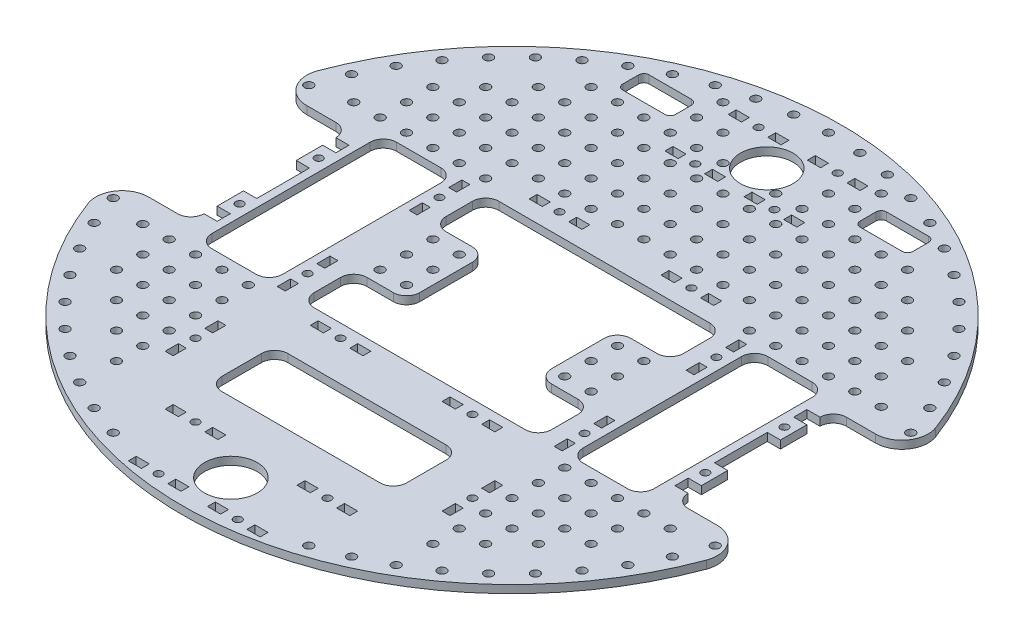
SolidWorks part; units mm, degrees
other "<Surchassis 5mm>-<<Chassis_Cachan_Coupe_2019>-<Bloc_moteur_assemble-1/Chassis_Cachan-1-solid1>>"
other "<Surchassis 5mm>-<<Chassis_Cachan_Coupe_2019>-<Assemblage_roue-1/Roue-1-solid1>>"
other "<Surchassis 5mm>-<<Chassis_Cachan_Coupe_2019>-<Assemblage_roue-1/spur gear_iso-1-solid1>>"
other "<Surchassis 5mm>-<<Chassis_Cachan_Coupe_2019>-<Assemblage_roue-2/Roue-1-solid1>>"
other "<Surchassis 5mm>-<<Chassis_Cachan_Coupe_2019>-<Assemblage_roue-2/spur gear_iso-1-solid1>>"
other "<Surchassis 5mm>-<Fillet1>"
ref_plane "Plan de face" through (0, 0, 0) normal (0, 0, 1) x (1, 0, 0)
ref_plane "Plan de dessus" through (0, 0, 0) normal (0, 1, 0) x (1, 0, 0)
ref_plane "Plan de droite" through (0, 0, 0) normal (1, 0, 0) x (0, 0, -1)
sketch "Esquisse1-Surchassis 5mm" plane through (19.3534, 43.7556, -15.1193) normal (0, 1, 0) x (1, 0, 0)
  line L0 (-90, 0) -> (90, 0) construction
  line L1 (-96, -30) -> (-113.0885, -30)
  line L2 (-51, 41.5) -> (58.6644, 41.5) construction
  line L4 (-96, -25) -> (-96, -30)
  line L5 (88.3, 10) -> (88.3, 20) construction
  line L6 (86.8, -10) -> (91.8, -10)
  line L7 (86.8, 10) -> (86.8, 5)
  line L8 (-89.8, -25) -> (-96, -25)
  line L9 (91.8, -10) -> (91.8, -20)
  line L10 (86.8, 5) -> (89.8, 5) construction
  line L11 (86.8, 20) -> (86.8, 25)
  line L12 (-86.8, -25) -> (-89.8, -25)
  line L13 (91.8, -20) -> (86.8, -20)
  line L14 (-86.8, -20) -> (-86.8, -25)
  line L15 (88.3, 15) -> (81.3276, 15) construction
  line L16 (88.3, -20) -> (88.3, -10) construction
  line L17 (86.8, -20) -> (86.8, -25)
  line L18 (-91.8, -20) -> (-86.8, -20)
  line L19 (-91.8, -10) -> (-91.8, -20)
  line L20 (86.8, -25) -> (89.8, -25)
  line L21 (86.8, -10) -> (86.8, -5)
  line L22 (-86.8, -10) -> (-91.8, -10)
  line L23 (89.8, -25) -> (96, -25)
  line L24 (86.8, -5) -> (89.8, -5) construction
  line L25 (88.3, -15) -> (81.3276, -15) construction
  line L26 (96, -25) -> (96, -30)
  line L27 (86.8, 10) -> (91.8, 10)
  line L28 (91.8, 10) -> (91.8, 20)
  line L29 (91.8, 20) -> (86.8, 20)
  line L30 (96, 30) -> (113.0885, 30)
  line L31 (96, 30) -> (96, -30) construction
  line L32 (96, -30) -> (113.0885, -30)
  line L33 (113.0885, 30) -> (113.0885, -30) construction
  line L34 (-86.8, -10) -> (-86.8, -5)
  line L35 (-86.8, -5) -> (-86.8, 5)
  line L36 (-86.8, 10) -> (-86.8, 5)
  line L37 (-86.8, 10) -> (-91.8, 10)
  line L38 (86.8, 25) -> (96, 25)
  line L39 (86.8, -5) -> (86.8, 5)
  line L40 (96, 25) -> (96, 30)
  line L41 (-91.8, 10) -> (-91.8, 20)
  line L42 (-91.8, 20) -> (-86.8, 20)
  line L43 (-86.8, 20) -> (-86.8, 25)
  line L44 (-86.8, 25) -> (-96, 25)
  line L45 (-96, 25) -> (-96, 30)
  line L46 (-96, 30) -> (-113.0885, 30)
  line L59 (0, 0) -> (0, -125) construction
  line L82 (0, -93.5) -> (0, -41.5) construction
  line L83 (-51, -93.5) -> (51, -93.5) construction
  line L84 (-51, -93.5) -> (-51, -41.5) construction
  line L85 (-51, -41.5) -> (51, -41.5) construction
  line L86 (51, -93.5) -> (51, -41.5) construction
  line L87 (-51, -67.5) -> (51, -67.5) construction
  line L91 (-44.985, -93.5) -> (-35.015, -93.5) construction
  line L94 (-24.985, -93.5) -> (-15.015, -93.5) construction
  line L98 (-4.985, -93.5) -> (4.985, -93.5) construction
  line L102 (15.015, -93.5) -> (24.985, -93.5) construction
  line L106 (35.015, -93.5) -> (44.985, -93.5) construction
  line L108 (-51, -41.5) -> (51, -41.5) construction
  line L110 (35.015, -41.5) -> (44.985, -41.5) construction
  line L114 (15.015, -41.5) -> (24.985, -41.5) construction
  line L118 (-4.985, -41.5) -> (4.985, -41.5) construction
  line L122 (-24.985, -41.5) -> (-15.015, -41.5) construction
  line L125 (-44.985, -41.5) -> (-35.015, -41.5) construction
  line L129 (51, -93.5) -> (51, -41.5) construction
  line L131 (-51, -93.485) -> (-51, -83.515) construction
  line L135 (-51, -73.485) -> (-51, -63.515) construction
  line L139 (-51, -53.485) -> (-51, -43.515) construction
  line L144 (51, -53.485) -> (51, -43.515) construction
  line L148 (51, -73.485) -> (51, -63.515) construction
  line L152 (51, -93.485) -> (51, -83.515) construction
  line L154 (-51, -93.485) -> (-51, -93.5) construction
  line L155 (-51, -93.5) -> (-44.985, -93.5) construction
  line L156 (-35.015, -93.5) -> (-24.985, -93.5) construction
  line L157 (-15.015, -93.5) -> (-4.985, -93.5) construction
  line L158 (4.985, -93.5) -> (15.015, -93.5) construction
  line L159 (24.985, -93.5) -> (35.015, -93.5) construction
  line L160 (44.985, -93.5) -> (51, -93.5) construction
  line L161 (51, -93.5) -> (51, -93.485) construction
  line L162 (51, -83.515) -> (51, -73.485) construction
  line L163 (51, -63.515) -> (51, -53.485) construction
  line L164 (51, -43.515) -> (51, -41.5) construction
  line L165 (51, -41.5) -> (44.985, -41.5) construction
  line L166 (35.015, -41.5) -> (24.985, -41.5) construction
  line L167 (15.015, -41.5) -> (4.985, -41.5) construction
  line L168 (-4.985, -41.5) -> (-15.015, -41.5) construction
  line L169 (-24.985, -41.5) -> (-35.015, -41.5) construction
  line L170 (-44.985, -41.5) -> (-51, -41.5) construction
  line L171 (-51, -41.5) -> (-51, -43.515) construction
  line L172 (-51, -53.485) -> (-51, -63.515) construction
  line L173 (-51, -73.485) -> (-51, -83.515) construction
  line L174 (125.9773, 20) -> (118.7192, 20) construction
  line L181 (-27.8375, -117.5) -> (13.4826, -117.5) construction
  line L190 (-20, -96.2) -> (-20, -145.4677) construction
  line L191 (-40, -96.2) -> (-40, -138) construction
  line L253 (-50.9895, 107) -> (24.0329, 107) construction
  line L262 (-38.4384, 83) -> (36.5098, 83) construction
  circle A0 centre (0, 0) radius 125
  circle A1 centre (88.3, 15) radius 1.5
  circle A2 centre (88.3, -15) radius 1.5
  circle A3 centre (-88.3, -15) radius 1.5
  circle A4 centre (-88.3, 15) radius 1.5
  arc A5 (-113.0885, -30) -> (-113.0885, 30) centre (0, 0) cw
  arc A32 (113.0885, -30) -> (113.0885, 30) centre (0, 0) ccw
  point P8 (0, 0)
  point P14 (36.5098, 83)
  point P17 (-38.4384, 83)
  point P18 (39.0316, 107)
  point P27 (-35.9908, 107)
  point P34 (0, 0)
  point P35 (0, 0)
  point P115 (86.8, 0)
  line B0 (-52.5, 20) -> (-52.5, 30) construction
  line B1 (-54, 20) -> (-54, 15)
  line B2 (-54, 20) -> (-51, 20)
  line B3 (-51, 20) -> (-51, 15)
  line B4 (-54, 15) -> (-51, 15)
  line B5 (-54, 30) -> (-54, 35)
  line B6 (-54, 30) -> (-51, 30)
  line B7 (-51, 30) -> (-51, 35)
  line B8 (-54, 35) -> (-51, 35)
  line B9 (-52.5, 25) -> (-59.4724, 25) construction
  circle B10 centre (-52.5, 25) radius 1.5
  line B11 (-52.5, -30) -> (-52.5, -20) construction
  line B12 (-54, -30) -> (-54, -35)
  line B13 (-54, -30) -> (-51, -30)
  line B14 (-51, -30) -> (-51, -35)
  line B15 (-54, -35) -> (-51, -35)
  line B16 (-54, -20) -> (-54, -15)
  line B17 (-54, -20) -> (-51, -20)
  line B18 (-51, -20) -> (-51, -15)
  line B19 (-54, -15) -> (-51, -15)
  line B20 (-52.5, -25) -> (-59.4724, -25) construction
  circle B21 centre (-52.5, -25) radius 1.5
  line B22 (52.5, 30) -> (52.5, 20) construction
  line B23 (54, 30) -> (54, 35)
  line B24 (54, 30) -> (51, 30)
  line B25 (51, 30) -> (51, 35)
  line B26 (54, 35) -> (51, 35)
  line B27 (54, 20) -> (54, 15)
  line B28 (54, 20) -> (51, 20)
  line B29 (51, 20) -> (51, 15)
  line B30 (54, 15) -> (51, 15)
  line B31 (52.5, 25) -> (59.4724, 25) construction
  circle B32 centre (52.5, 25) radius 1.5
  line B33 (52.5, -20) -> (52.5, -30) construction
  line B34 (54, -20) -> (54, -15)
  line B35 (54, -20) -> (51, -20)
  line B36 (51, -20) -> (51, -15)
  line B37 (54, -15) -> (51, -15)
  line B38 (54, -30) -> (54, -35)
  line B39 (54, -30) -> (51, -30)
  line B40 (51, -30) -> (51, -35)
  line B41 (54, -35) -> (51, -35)
  line B42 (52.5, -25) -> (59.4724, -25) construction
  circle B43 centre (52.5, -25) radius 1.5
  line B44 (-30, 43) -> (-20, 43) construction
  line B45 (-30, 44.5) -> (-35, 44.5)
  line B46 (-30, 44.5) -> (-30, 41.5)
  line B47 (-30, 41.5) -> (-35, 41.5)
  line B48 (-35, 44.5) -> (-35, 41.5)
  line B49 (-20, 44.5) -> (-15, 44.5)
  line B50 (-20, 44.5) -> (-20, 41.5)
  line B51 (-20, 41.5) -> (-15, 41.5)
  line B52 (-15, 44.5) -> (-15, 41.5)
  line B53 (-25, 43) -> (-25, 49.9724) construction
  circle B54 centre (-25, 43) radius 1.5
  line B55 (20, 43) -> (30, 43) construction
  line B56 (20, 44.5) -> (15, 44.5)
  line B57 (20, 44.5) -> (20, 41.5)
  line B58 (20, 41.5) -> (15, 41.5)
  line B59 (15, 44.5) -> (15, 41.5)
  line B60 (30, 44.5) -> (35, 44.5)
  line B61 (30, 44.5) -> (30, 41.5)
  line B62 (30, 41.5) -> (35, 41.5)
  line B63 (35, 44.5) -> (35, 41.5)
  line B64 (25, 43) -> (25, 49.9724) construction
  circle B65 centre (25, 43) radius 1.5
  line B66 (-52.5, -72.5) -> (-52.5, -62.5) construction
  line B67 (-54, -72.5) -> (-54, -77.5)
  line B68 (-54, -72.5) -> (-51, -72.5)
  line B69 (-51, -72.5) -> (-51, -77.5)
  line B70 (-54, -77.5) -> (-51, -77.5)
  line B71 (-54, -62.5) -> (-54, -57.5)
  line B72 (-54, -62.5) -> (-51, -62.5)
  line B73 (-51, -62.5) -> (-51, -57.5)
  line B74 (-54, -57.5) -> (-51, -57.5)
  line B75 (-52.5, -67.5) -> (-59.4724, -67.5) construction
  circle B76 centre (-52.5, -67.5) radius 1.5
  line B77 (20, -40) -> (30, -40) construction
  line B78 (20, -38.5) -> (15, -38.5)
  line B79 (20, -38.5) -> (20, -41.5)
  line B80 (20, -41.5) -> (15, -41.5)
  line B81 (15, -38.5) -> (15, -41.5)
  line B82 (30, -38.5) -> (35, -38.5)
  line B83 (30, -38.5) -> (30, -41.5)
  line B84 (30, -41.5) -> (35, -41.5)
  line B85 (35, -38.5) -> (35, -41.5)
  line B86 (25, -40) -> (25, -33.0276) construction
  circle B87 centre (25, -40) radius 1.5
  line B88 (-30, -40) -> (-20, -40) construction
  line B89 (-30, -38.5) -> (-35, -38.5)
  line B90 (-30, -38.5) -> (-30, -41.5)
  line B91 (-30, -41.5) -> (-35, -41.5)
  line B92 (-35, -38.5) -> (-35, -41.5)
  line B93 (-20, -38.5) -> (-15, -38.5)
  line B94 (-20, -38.5) -> (-20, -41.5)
  line B95 (-20, -41.5) -> (-15, -41.5)
  line B96 (-15, -38.5) -> (-15, -41.5)
  line B97 (-25, -40) -> (-25, -33.0276) construction
  circle B98 centre (-25, -40) radius 1.5
  line B99 (-30, -95) -> (-20, -95) construction
  line B100 (-30, -93.5) -> (-35, -93.5)
  line B101 (-30, -93.5) -> (-30, -96.5)
  line B102 (-30, -96.5) -> (-35, -96.5)
  line B103 (-35, -93.5) -> (-35, -96.5)
  line B104 (-20, -93.5) -> (-15, -93.5)
  line B105 (-20, -93.5) -> (-20, -96.5)
  line B106 (-20, -96.5) -> (-15, -96.5)
  line B107 (-15, -93.5) -> (-15, -96.5)
  line B108 (-25, -95) -> (-25, -88.0276) construction
  circle B109 centre (-25, -95) radius 1.5
  line B110 (20, -95) -> (30, -95) construction
  line B111 (20, -93.5) -> (15, -93.5)
  line B112 (20, -93.5) -> (20, -96.5)
  line B113 (20, -96.5) -> (15, -96.5)
  line B114 (15, -93.5) -> (15, -96.5)
  line B115 (30, -93.5) -> (35, -93.5)
  line B116 (30, -93.5) -> (30, -96.5)
  line B117 (30, -96.5) -> (35, -96.5)
  line B118 (35, -93.5) -> (35, -96.5)
  line B119 (25, -95) -> (25, -88.0276) construction
  circle B120 centre (25, -95) radius 1.5
  line B121 (52.5, -62.5) -> (52.5, -72.5) construction
  line B122 (54, -62.5) -> (54, -57.5)
  line B123 (54, -62.5) -> (51, -62.5)
  line B124 (51, -62.5) -> (51, -57.5)
  line B125 (54, -57.5) -> (51, -57.5)
  line B126 (54, -72.5) -> (54, -77.5)
  line B127 (54, -72.5) -> (51, -72.5)
  line B128 (51, -72.5) -> (51, -77.5)
  line B129 (54, -77.5) -> (51, -77.5)
  line B130 (52.5, -67.5) -> (59.4724, -67.5) construction
  circle B131 centre (52.5, -67.5) radius 1.5
  line B132 (10, -119) -> (20, -119) construction
  line B133 (10, -117.5) -> (5, -117.5)
  line B134 (10, -117.5) -> (10, -120.5)
  line B135 (10, -120.5) -> (5, -120.5)
  line B136 (5, -117.5) -> (5, -120.5)
  line B137 (20, -117.5) -> (25, -117.5)
  line B138 (20, -117.5) -> (20, -120.5)
  line B139 (20, -120.5) -> (25, -120.5)
  line B140 (25, -117.5) -> (25, -120.5)
  line B141 (15, -119) -> (15, -112.0276) construction
  circle B142 centre (15, -119) radius 1.5
  line B143 (-20, -119) -> (-10, -119) construction
  line B144 (-20, -117.5) -> (-25, -117.5)
  line B145 (-20, -117.5) -> (-20, -120.5)
  line B146 (-20, -120.5) -> (-25, -120.5)
  line B147 (-25, -117.5) -> (-25, -120.5)
  line B148 (-10, -117.5) -> (-5, -117.5)
  line B149 (-10, -117.5) -> (-10, -120.5)
  line B150 (-10, -120.5) -> (-5, -120.5)
  line B151 (-5, -117.5) -> (-5, -120.5)
  line B152 (-15, -119) -> (-15, -112.0276) construction
  circle B153 centre (-15, -119) radius 1.5
  line B154 (-20, 84.5) -> (-10, 84.5) construction
  line B155 (-20, 86) -> (-25, 86)
  line B156 (-20, 86) -> (-20, 83)
  line B157 (-20, 83) -> (-25, 83)
  line B158 (-25, 86) -> (-25, 83)
  line B159 (-10, 86) -> (-5, 86)
  line B160 (-10, 86) -> (-10, 83)
  line B161 (-10, 83) -> (-5, 83)
  line B162 (-5, 86) -> (-5, 83)
  line B163 (-15, 84.5) -> (-15, 91.4724) construction
  circle B164 centre (-15, 84.5) radius 1.5
  line B165 (10, 84.5) -> (20, 84.5) construction
  line B166 (10, 86) -> (5, 86)
  line B167 (10, 86) -> (10, 83)
  line B168 (10, 83) -> (5, 83)
  line B169 (5, 86) -> (5, 83)
  line B170 (20, 86) -> (25, 86)
  line B171 (20, 86) -> (20, 83)
  line B172 (20, 83) -> (25, 83)
  line B173 (25, 86) -> (25, 83)
  line B174 (15, 84.5) -> (15, 91.4724) construction
  circle B175 centre (15, 84.5) radius 1.5
  line B176 (10, 108.5) -> (20, 108.5) construction
  line B177 (10, 110) -> (5, 110)
  line B178 (10, 110) -> (10, 107)
  line B179 (10, 107) -> (5, 107)
  line B180 (5, 110) -> (5, 107)
  line B181 (20, 110) -> (25, 110)
  line B182 (20, 110) -> (20, 107)
  line B183 (20, 107) -> (25, 107)
  line B184 (25, 110) -> (25, 107)
  line B185 (15, 108.5) -> (15, 115.4724) construction
  circle B186 centre (15, 108.5) radius 1.5
  line B187 (-20, 108.5) -> (-10, 108.5) construction
  line B188 (-20, 110) -> (-25, 110)
  line B189 (-20, 110) -> (-20, 107)
  line B190 (-20, 107) -> (-25, 107)
  line B191 (-25, 110) -> (-25, 107)
  line B192 (-10, 110) -> (-5, 110)
  line B193 (-10, 110) -> (-10, 107)
  line B194 (-10, 107) -> (-5, 107)
  line B195 (-5, 110) -> (-5, 107)
  line B196 (-15, 108.5) -> (-15, 115.4724) construction
  circle B197 centre (-15, 108.5) radius 1.5
sketch_block_instance "Insert M3 avec plot 3mm coté trou-21-18-1"
sketch_block "Insert M3 avec plot 3mm coté trou-21-18" parameters "D2"=3, "D1"=3, "D3"=5, "D4"=10
sketch_block_instance "Insert M3 avec plot 3mm coté trou-21-18-2"
sketch_block_instance "Insert M3 avec plot 3mm coté trou-21-18-3"
sketch_block_instance "Insert M3 avec plot 3mm coté trou-21-18-4"
sketch_block_instance "Insert M3 avec plot 3mm coté trou-21-18-5"
sketch_block_instance "Insert M3 avec plot 3mm coté trou-21-18-6"
sketch_block_instance "Insert M3 avec plot 3mm coté trou-21-18-7"
sketch_block_instance "Insert M3 avec plot 3mm coté trou-21-18-8"
sketch_block_instance "Insert M3 avec plot 3mm coté trou-21-18-9"
sketch_block_instance "Insert M3 avec plot 3mm coté trou-21-18-10"
sketch_block_instance "Insert M3 avec plot 3mm coté trou-21-18-11"
sketch_block_instance "Insert M3 avec plot 3mm coté trou-21-18-12"
sketch_block_instance "Insert M3 avec plot 3mm coté trou-21-18-13"
sketch_block_instance "Insert M3 avec plot 3mm coté trou-21-18-14"
sketch_block_instance "Insert M3 avec plot 3mm coté trou-21-18-15"
sketch_block_instance "Insert M3 avec plot 3mm coté trou-21-18-16"
sketch_block_instance "Insert M3 avec plot 3mm coté trou-21-18-17"
sketch_block_instance "Insert M3 avec plot 3mm coté trou-21-17-17" parameters "D4"=3.4, "D8"=297, "D21"=312.2688, "D5"=117, "D23"=3, "D28"=3, "D1"=247, "D2"=18.4229, "D3"=23.1749, "D6"=60, "D7"=60, "D9"=4.3401, "D10"=9.5969, "D11"=10, "D13"=10, "D12"=6.3355, "D14"=131.6053, "D15"=51.4209, "D16"=100, "D17"=14.4362, "D18"=4.6468, "D19"=14.5354, "D20"=3, "D22"=3.3217, "D24"=10, "D25"=10.15, "D26"=10.15, "D27"=2.85, "D29"=13.5312, "D30"=16.4043, "D31"=7.4814, "D32"=12.925, "D33"=12.925, "D34"=3, "D35"=100, "D36"=90, "D37"=29.1125, "D38"=30.7336, "D39"=21.1863, "D40"=25.1811, "D41"=18.0976
sketch "Esquisse2-Surchassis 5mm" plane through (19.3534, 46.7556, -15.1193) normal (0, 1, 0) x (1, 0, 0)
  line L0 (-125, 0) -> (125, 0) construction
  line L1 (0, -125) -> (0, 125) construction
  line L2 (-45, -35) -> (-45, -15)
  line L3 (-45, 35) -> (-15, 35)
  line L6 (-50, -42.5) -> (50, -42.5)
  line L7 (-50, -42.5) -> (-50, -92.5)
  line L8 (-50, -92.5) -> (50, -92.5)
  line L10 (50, -42.5) -> (50, -92.5)
  line L14 (-45, 35) -> (-45, 15)
  line L15 (-45, 15) -> (-15, 15)
  line L16 (-15, 35) -> (-15, 15)
  line L17 (-45, -15) -> (-15, -15)
  line L18 (-15, -35) -> (-15, -15)
  line L19 (-45, -35) -> (-15, -35)
  line L20 (45, -35) -> (45, -15)
  line L21 (45, -35) -> (15, -35)
  line L22 (15, -35) -> (15, -15)
  line L23 (45, -15) -> (15, -15)
  line L24 (45, 35) -> (45, 15)
  line L25 (45, 15) -> (15, 15)
  line L26 (15, 35) -> (15, 15)
  line L27 (45, 35) -> (15, 35)
  line L28 (55, 105) -> (55, 95)
  line L29 (-55, 105) -> (-35, 105)
  line L30 (-55, 105) -> (-55, 95)
  line L31 (-55, 95) -> (-35, 95)
  line L32 (-35, 105) -> (-35, 95)
  line L33 (55, 95) -> (35, 95)
  line L34 (35, 105) -> (35, 95)
  line L35 (55, 105) -> (35, 105)
  circle A0 centre (0, 0) radius 1.65
  circle A2 centre (10, 0) radius 1.65
  circle A3 centre (20, 0) radius 1.65
  circle A4 centre (30, 0) radius 1.65
  circle A5 centre (40, 0) radius 1.65
  circle A6 centre (50, 0) radius 1.65 construction
  circle A7 centre (60, 0) radius 1.65
  circle A8 centre (70, 0) radius 1.65
  circle A9 centre (80, 0) radius 1.65
  circle A10 centre (90, 0) radius 1.65 construction
  circle A11 centre (100, 0) radius 1.65 construction
  circle A12 centre (110, 0) radius 1.65 construction
  circle A13 centre (120, 0) radius 1.65 construction
  circle A14 centre (10, 10) radius 1.65
  circle A15 centre (20, 10) radius 1.65
  circle A16 centre (30, 10) radius 1.65
  circle A17 centre (40, 10) radius 1.65
  circle A18 centre (50, 10) radius 1.65 construction
  circle A19 centre (60, 10) radius 1.65
  circle A20 centre (70, 10) radius 1.65
  circle A21 centre (80, 10) radius 1.65
  circle A22 centre (90, 10) radius 1.65 construction
  circle A23 centre (100, 10) radius 1.65 construction
  circle A24 centre (110, 10) radius 1.65 construction
  circle A25 centre (120, 10) radius 1.65 construction
  circle A26 centre (10, 20) radius 1.65
  circle A27 centre (20, 20) radius 1.65 construction
  circle A28 centre (30, 20) radius 1.65 construction
  circle A29 centre (40, 20) radius 1.65 construction
  circle A30 centre (50, 20) radius 1.65 construction
  circle A31 centre (60, 20) radius 1.65
  circle A32 centre (70, 20) radius 1.65
  circle A33 centre (80, 20) radius 1.65
  circle A34 centre (90, 20) radius 1.65 construction
  circle A35 centre (100, 20) radius 1.65 construction
  circle A36 centre (110, 20) radius 1.65 construction
  circle A37 centre (120, 20) radius 1.65 construction
  circle A38 centre (10, 30) radius 1.65
  circle A39 centre (20, 30) radius 1.65 construction
  circle A40 centre (30, 30) radius 1.65 construction
  circle A41 centre (40, 30) radius 1.65 construction
  circle A42 centre (50, 30) radius 1.65 construction
  circle A43 centre (60, 30) radius 1.65
  circle A44 centre (70, 30) radius 1.65
  circle A45 centre (80, 30) radius 1.65
  circle A46 centre (90, 30) radius 1.65 construction
  circle A47 centre (100, 30) radius 1.65 construction
  circle A48 centre (110, 30) radius 1.65 construction
  circle A49 centre (120, 30) radius 1.65 construction
  circle A50 centre (10, 40) radius 1.65 construction
  circle A51 centre (20, 40) radius 1.65 construction
  circle A52 centre (30, 40) radius 1.65 construction
  circle A53 centre (40, 40) radius 1.65 construction
  circle A54 centre (50, 40) radius 1.65
  circle A55 centre (60, 40) radius 1.65
  circle A56 centre (70, 40) radius 1.65
  circle A57 centre (80, 40) radius 1.65
  circle A58 centre (90, 40) radius 1.65
  circle A59 centre (100, 40) radius 1.65
  circle A60 centre (110, 40) radius 1.65 construction
  circle A61 centre (120, 40) radius 1.65 construction
  circle A62 centre (10, 50) radius 1.65
  circle A63 centre (20, 50) radius 1.65
  circle A64 centre (30, 50) radius 1.65
  circle A65 centre (40, 50) radius 1.65
  circle A66 centre (50, 50) radius 1.65
  circle A67 centre (60, 50) radius 1.65
  circle A68 centre (70, 50) radius 1.65
  circle A69 centre (80, 50) radius 1.65
  circle A70 centre (90, 50) radius 1.65
  circle A71 centre (100, 50) radius 1.65 construction
  circle A72 centre (110, 50) radius 1.65 construction
  circle A73 centre (120, 50) radius 1.65 construction
  circle A74 centre (10, 60) radius 1.65
  circle A75 centre (20, 60) radius 1.65
  circle A76 centre (30, 60) radius 1.65
  circle A77 centre (40, 60) radius 1.65
  circle A78 centre (50, 60) radius 1.65
  circle A79 centre (60, 60) radius 1.65
  circle A80 centre (70, 60) radius 1.65
  circle A81 centre (80, 60) radius 1.65
  circle A82 centre (90, 60) radius 1.65
  circle A83 centre (100, 60) radius 1.65 construction
  circle A84 centre (110, 60) radius 1.65 construction
  circle A85 centre (120, 60) radius 1.65 construction
  circle A86 centre (10, 70) radius 1.65
  circle A87 centre (20, 70) radius 1.65
  circle A88 centre (30, 70) radius 1.65
  circle A89 centre (40, 70) radius 1.65
  circle A90 centre (50, 70) radius 1.65
  circle A91 centre (60, 70) radius 1.65
  circle A92 centre (70, 70) radius 1.65
  circle A93 centre (80, 70) radius 1.65
  circle A94 centre (90, 70) radius 1.65 construction
  circle A95 centre (100, 70) radius 1.65 construction
  circle A96 centre (110, 70) radius 1.65 construction
  circle A97 centre (120, 70) radius 1.65 construction
  circle A98 centre (10, 80) radius 1.65
  circle A99 centre (20, 80) radius 1.65
  circle A100 centre (30, 80) radius 1.65
  circle A101 centre (40, 80) radius 1.65
  circle A102 centre (50, 80) radius 1.65
  circle A103 centre (60, 80) radius 1.65
  circle A104 centre (70, 80) radius 1.65
  circle A105 centre (80, 80) radius 1.65 construction
  circle A106 centre (90, 80) radius 1.65 construction
  circle A107 centre (100, 80) radius 1.65 construction
  circle A108 centre (110, 80) radius 1.65 construction
  circle A109 centre (120, 80) radius 1.65 construction
  circle A110 centre (10, 90) radius 1.65
  circle A111 centre (20, 90) radius 1.65
  circle A112 centre (30, 90) radius 1.65
  circle A113 centre (40, 90) radius 1.65
  circle A114 centre (50, 90) radius 1.65
  circle A115 centre (60, 90) radius 1.65
  circle A116 centre (70, 90) radius 1.65 construction
  circle A117 centre (80, 90) radius 1.65 construction
  circle A118 centre (90, 90) radius 1.65 construction
  circle A119 centre (100, 90) radius 1.65 construction
  circle A120 centre (110, 90) radius 1.65 construction
  circle A121 centre (120, 90) radius 1.65 construction
  circle A122 centre (10, 100) radius 1.65 construction
  circle A123 centre (20, 100) radius 1.65
  circle A124 centre (30, 100) radius 1.65
  circle A125 centre (40, 100) radius 1.65 construction
  circle A126 centre (50, 100) radius 1.65 construction
  circle A127 centre (60, 100) radius 1.65 construction
  circle A128 centre (70, 100) radius 1.65 construction
  circle A129 centre (80, 100) radius 1.65 construction
  circle A130 centre (90, 100) radius 1.65 construction
  circle A131 centre (100, 100) radius 1.65 construction
  circle A132 centre (110, 100) radius 1.65 construction
  circle A133 centre (120, 100) radius 1.65 construction
  circle A134 centre (10, 110) radius 1.65 construction
  circle A135 centre (20, 110) radius 1.65 construction
  circle A136 centre (30, 110) radius 1.65
  circle A137 centre (40, 110) radius 1.65 construction
  circle A138 centre (50, 110) radius 1.65 construction
  circle A139 centre (60, 110) radius 1.65 construction
  circle A140 centre (70, 110) radius 1.65 construction
  circle A141 centre (80, 110) radius 1.65 construction
  circle A142 centre (90, 110) radius 1.65 construction
  circle A143 centre (100, 110) radius 1.65 construction
  circle A144 centre (110, 110) radius 1.65 construction
  circle A145 centre (120, 110) radius 1.65 construction
  circle A146 centre (10, 120) radius 1.65 construction
  circle A147 centre (20, 120) radius 1.65 construction
  circle A148 centre (30, 120) radius 1.65 construction
  circle A149 centre (40, 120) radius 1.65 construction
  circle A150 centre (50, 120) radius 1.65 construction
  circle A151 centre (60, 120) radius 1.65 construction
  circle A152 centre (70, 120) radius 1.65 construction
  circle A153 centre (80, 120) radius 1.65 construction
  circle A154 centre (90, 120) radius 1.65 construction
  circle A155 centre (100, 120) radius 1.65 construction
  circle A156 centre (110, 120) radius 1.65 construction
  circle A157 centre (120, 120) radius 1.65 construction
  circle A158 centre (0, 10) radius 1.65
  circle A159 centre (0, 20) radius 1.65
  circle A160 centre (0, 30) radius 1.65
  circle A161 centre (0, 40) radius 1.65 construction
  circle A162 centre (0, 50) radius 1.65
  circle A163 centre (0, 60) radius 1.65
  circle A164 centre (0, 70) radius 1.65
  circle A165 centre (0, 80) radius 1.65
  circle A166 centre (0, 90) radius 1.65
  circle A167 centre (0, 100) radius 1.65
  circle A168 centre (0, 110) radius 1.65 construction
  circle A169 centre (0, 120) radius 1.65
  circle A170 centre (-120, 120) radius 1.65 construction
  circle A171 centre (-110, 120) radius 1.65 construction
  circle A172 centre (-100, 120) radius 1.65 construction
  circle A173 centre (-90, 120) radius 1.65 construction
  circle A174 centre (-80, 120) radius 1.65 construction
  circle A175 centre (-70, 120) radius 1.65 construction
  circle A176 centre (-60, 120) radius 1.65 construction
  circle A177 centre (-50, 120) radius 1.65 construction
  circle A178 centre (-40, 120) radius 1.65 construction
  circle A179 centre (-30, 120) radius 1.65 construction
  circle A180 centre (-20, 120) radius 1.65 construction
  circle A181 centre (-10, 120) radius 1.65 construction
  circle A182 centre (-120, 110) radius 1.65 construction
  circle A183 centre (-110, 110) radius 1.65 construction
  circle A184 centre (-100, 110) radius 1.65 construction
  circle A185 centre (-90, 110) radius 1.65 construction
  circle A186 centre (-80, 110) radius 1.65 construction
  circle A187 centre (-70, 110) radius 1.65 construction
  circle A188 centre (-60, 110) radius 1.65 construction
  circle A189 centre (-50, 110) radius 1.65 construction
  circle A190 centre (-40, 110) radius 1.65 construction
  circle A191 centre (-120, 100) radius 1.65 construction
  circle A192 centre (-110, 100) radius 1.65 construction
  circle A193 centre (-100, 100) radius 1.65 construction
  circle A194 centre (-90, 100) radius 1.65 construction
  circle A195 centre (-80, 100) radius 1.65 construction
  circle A196 centre (-70, 100) radius 1.65 construction
  circle A197 centre (-60, 100) radius 1.65 construction
  circle A198 centre (-120, 90) radius 1.65 construction
  circle A199 centre (-110, 90) radius 1.65 construction
  circle A200 centre (-100, 90) radius 1.65 construction
  circle A201 centre (-90, 90) radius 1.65 construction
  circle A202 centre (-80, 90) radius 1.65 construction
  circle A203 centre (-70, 90) radius 1.65 construction
  circle A204 centre (-120, 80) radius 1.65 construction
  circle A205 centre (-110, 80) radius 1.65 construction
  circle A206 centre (-100, 80) radius 1.65 construction
  circle A207 centre (-90, 80) radius 1.65 construction
  circle A208 centre (-80, 80) radius 1.65 construction
  circle A209 centre (-120, 70) radius 1.65 construction
  circle A210 centre (-110, 70) radius 1.65 construction
  circle A211 centre (-100, 70) radius 1.65 construction
  circle A212 centre (-90, 70) radius 1.65 construction
  circle A213 centre (-120, 60) radius 1.65 construction
  circle A214 centre (-110, 60) radius 1.65 construction
  circle A215 centre (-100, 60) radius 1.65 construction
  circle A216 centre (-120, 50) radius 1.65 construction
  circle A217 centre (-110, 50) radius 1.65 construction
  circle A218 centre (-100, 50) radius 1.65 construction
  circle A219 centre (-120, 40) radius 1.65 construction
  circle A220 centre (-110, 40) radius 1.65 construction
  circle A221 centre (-50, 40) radius 1.65
  circle A222 centre (-120, 30) radius 1.65 construction
  circle A223 centre (-110, 30) radius 1.65 construction
  circle A224 centre (-100, 30) radius 1.65 construction
  circle A225 centre (-90, 30) radius 1.65 construction
  circle A226 centre (-50, 30) radius 1.65 construction
  circle A227 centre (-120, 20) radius 1.65 construction
  circle A228 centre (-110, 20) radius 1.65 construction
  circle A229 centre (-100, 20) radius 1.65 construction
  circle A230 centre (-90, 20) radius 1.65 construction
  circle A231 centre (-50, 20) radius 1.65 construction
  circle A232 centre (-120, 10) radius 1.65 construction
  circle A233 centre (-110, 10) radius 1.65 construction
  circle A234 centre (-100, 10) radius 1.65 construction
  circle A235 centre (-90, 10) radius 1.65 construction
  circle A236 centre (-50, 10) radius 1.65 construction
  circle A237 centre (-120, 0) radius 1.65 construction
  circle A238 centre (-110, 0) radius 1.65 construction
  circle A239 centre (-100, 0) radius 1.65 construction
  circle A240 centre (-90, 0) radius 1.65 construction
  circle A241 centre (-50, 0) radius 1.65 construction
  circle A242 centre (-30, 110) radius 1.65
  circle A243 centre (-20, 110) radius 1.65 construction
  circle A244 centre (-10, 110) radius 1.65 construction
  circle A245 centre (-50, 100) radius 1.65 construction
  circle A246 centre (-40, 100) radius 1.65 construction
  circle A247 centre (-30, 100) radius 1.65
  circle A248 centre (-20, 100) radius 1.65
  circle A249 centre (-10, 100) radius 1.65 construction
  circle A250 centre (-60, 90) radius 1.65
  circle A251 centre (-50, 90) radius 1.65
  circle A252 centre (-40, 90) radius 1.65
  circle A253 centre (-30, 90) radius 1.65
  circle A254 centre (-20, 90) radius 1.65
  circle A255 centre (-10, 90) radius 1.65
  circle A256 centre (-70, 80) radius 1.65
  circle A257 centre (-60, 80) radius 1.65
  circle A258 centre (-50, 80) radius 1.65
  circle A259 centre (-40, 80) radius 1.65
  circle A260 centre (-30, 80) radius 1.65
  circle A261 centre (-20, 80) radius 1.65
  circle A262 centre (-10, 80) radius 1.65
  circle A263 centre (-80, 70) radius 1.65
  circle A264 centre (-70, 70) radius 1.65
  circle A265 centre (-60, 70) radius 1.65
  circle A266 centre (-50, 70) radius 1.65
  circle A267 centre (-40, 70) radius 1.65
  circle A268 centre (-30, 70) radius 1.65
  circle A269 centre (-20, 70) radius 1.65
  circle A270 centre (-10, 70) radius 1.65
  circle A271 centre (-90, 60) radius 1.65
  circle A272 centre (-80, 60) radius 1.65
  circle A273 centre (-70, 60) radius 1.65
  circle A274 centre (-60, 60) radius 1.65
  circle A275 centre (-50, 60) radius 1.65
  circle A276 centre (-40, 60) radius 1.65
  circle A277 centre (-30, 60) radius 1.65
  circle A278 centre (-20, 60) radius 1.65
  circle A279 centre (-10, 60) radius 1.65
  circle A280 centre (-90, 50) radius 1.65
  circle A281 centre (-80, 50) radius 1.65
  circle A282 centre (-70, 50) radius 1.65
  circle A283 centre (-60, 50) radius 1.65
  circle A284 centre (-50, 50) radius 1.65
  circle A285 centre (-40, 50) radius 1.65
  circle A286 centre (-30, 50) radius 1.65
  circle A287 centre (-20, 50) radius 1.65
  circle A288 centre (-10, 50) radius 1.65
  circle A289 centre (-100, 40) radius 1.65
  circle A290 centre (-90, 40) radius 1.65
  circle A291 centre (-80, 40) radius 1.65
  circle A292 centre (-70, 40) radius 1.65
  circle A293 centre (-60, 40) radius 1.65
  circle A294 centre (-40, 40) radius 1.65 construction
  circle A295 centre (-30, 40) radius 1.65 construction
  circle A296 centre (-20, 40) radius 1.65 construction
  circle A297 centre (-10, 40) radius 1.65 construction
  circle A298 centre (-80, 30) radius 1.65
  circle A299 centre (-70, 30) radius 1.65
  circle A300 centre (-60, 30) radius 1.65
  circle A301 centre (-40, 30) radius 1.65 construction
  circle A302 centre (-30, 30) radius 1.65 construction
  circle A303 centre (-20, 30) radius 1.65 construction
  circle A304 centre (-10, 30) radius 1.65
  circle A305 centre (-80, 20) radius 1.65
  circle A306 centre (-70, 20) radius 1.65
  circle A307 centre (-60, 20) radius 1.65
  circle A308 centre (-40, 20) radius 1.65 construction
  circle A309 centre (-30, 20) radius 1.65 construction
  circle A310 centre (-20, 20) radius 1.65 construction
  circle A311 centre (-10, 20) radius 1.65
  circle A312 centre (-80, 10) radius 1.65
  circle A313 centre (-70, 10) radius 1.65
  circle A314 centre (-60, 10) radius 1.65
  circle A315 centre (-40, 10) radius 1.65
  circle A316 centre (-30, 10) radius 1.65
  circle A317 centre (-20, 10) radius 1.65
  circle A318 centre (-10, 10) radius 1.65
  circle A319 centre (-80, 0) radius 1.65
  circle A320 centre (-70, 0) radius 1.65
  circle A321 centre (-60, 0) radius 1.65
  circle A322 centre (-40, 0) radius 1.65
  circle A323 centre (-30, 0) radius 1.65
  circle A324 centre (-20, 0) radius 1.65
  circle A325 centre (-10, 0) radius 1.65
  circle A326 centre (-50, -10) radius 1.65 construction
  circle A327 centre (-90, -10) radius 1.65 construction
  circle A328 centre (-100, -10) radius 1.65 construction
  circle A329 centre (-110, -10) radius 1.65 construction
  circle A330 centre (-120, -10) radius 1.65 construction
  circle A331 centre (-50, -20) radius 1.65 construction
  circle A332 centre (-90, -20) radius 1.65 construction
  circle A333 centre (-100, -20) radius 1.65 construction
  circle A334 centre (-110, -20) radius 1.65 construction
  circle A335 centre (-120, -20) radius 1.65 construction
  circle A336 centre (-50, -30) radius 1.65 construction
  circle A337 centre (-90, -30) radius 1.65 construction
  circle A338 centre (-100, -30) radius 1.65 construction
  circle A339 centre (-110, -30) radius 1.65 construction
  circle A340 centre (-120, -30) radius 1.65 construction
  circle A341 centre (-50, -40) radius 1.65 construction
  circle A342 centre (-110, -40) radius 1.65 construction
  circle A343 centre (-120, -40) radius 1.65 construction
  circle A344 centre (-100, -50) radius 1.65 construction
  circle A345 centre (-110, -50) radius 1.65 construction
  circle A346 centre (-120, -50) radius 1.65 construction
  circle A347 centre (-100, -60) radius 1.65 construction
  circle A348 centre (-110, -60) radius 1.65 construction
  circle A349 centre (-120, -60) radius 1.65 construction
  circle A350 centre (-90, -70) radius 1.65 construction
  circle A351 centre (-100, -70) radius 1.65 construction
  circle A352 centre (-110, -70) radius 1.65 construction
  circle A353 centre (-120, -70) radius 1.65 construction
  circle A354 centre (-80, -80) radius 1.65 construction
  circle A355 centre (-90, -80) radius 1.65 construction
  circle A356 centre (-100, -80) radius 1.65 construction
  circle A357 centre (-110, -80) radius 1.65 construction
  circle A358 centre (-120, -80) radius 1.65 construction
  circle A359 centre (-70, -90) radius 1.65 construction
  circle A360 centre (-80, -90) radius 1.65 construction
  circle A361 centre (-90, -90) radius 1.65 construction
  circle A362 centre (-100, -90) radius 1.65 construction
  circle A363 centre (-110, -90) radius 1.65 construction
  circle A364 centre (-120, -90) radius 1.65 construction
  circle A365 centre (-60, -100) radius 1.65 construction
  circle A366 centre (-70, -100) radius 1.65 construction
  circle A367 centre (-80, -100) radius 1.65 construction
  circle A368 centre (-90, -100) radius 1.65 construction
  circle A369 centre (-100, -100) radius 1.65 construction
  circle A370 centre (-110, -100) radius 1.65 construction
  circle A371 centre (-120, -100) radius 1.65 construction
  circle A372 centre (-40, -110) radius 1.65 construction
  circle A373 centre (-50, -110) radius 1.65 construction
  circle A374 centre (-60, -110) radius 1.65 construction
  circle A375 centre (-70, -110) radius 1.65 construction
  circle A376 centre (-80, -110) radius 1.65 construction
  circle A377 centre (-90, -110) radius 1.65 construction
  circle A378 centre (-100, -110) radius 1.65 construction
  circle A379 centre (-110, -110) radius 1.65 construction
  circle A380 centre (-120, -110) radius 1.65 construction
  circle A381 centre (-10, -120) radius 1.65 construction
  circle A382 centre (-20, -120) radius 1.65 construction
  circle A383 centre (-30, -120) radius 1.65 construction
  circle A384 centre (-40, -120) radius 1.65 construction
  circle A385 centre (-50, -120) radius 1.65 construction
  circle A386 centre (-60, -120) radius 1.65 construction
  circle A387 centre (-70, -120) radius 1.65 construction
  circle A388 centre (-80, -120) radius 1.65 construction
  circle A389 centre (-90, -120) radius 1.65 construction
  circle A390 centre (-100, -120) radius 1.65 construction
  circle A391 centre (-110, -120) radius 1.65 construction
  circle A392 centre (-120, -120) radius 1.65 construction
  circle A393 centre (0, -120) radius 1.65 construction
  circle A394 centre (120, -120) radius 1.65 construction
  circle A395 centre (110, -120) radius 1.65 construction
  circle A396 centre (100, -120) radius 1.65 construction
  circle A397 centre (90, -120) radius 1.65 construction
  circle A398 centre (80, -120) radius 1.65 construction
  circle A399 centre (70, -120) radius 1.65 construction
  circle A400 centre (60, -120) radius 1.65 construction
  circle A401 centre (50, -120) radius 1.65 construction
  circle A402 centre (40, -120) radius 1.65 construction
  circle A403 centre (30, -120) radius 1.65 construction
  circle A404 centre (20, -120) radius 1.65 construction
  circle A405 centre (10, -120) radius 1.65 construction
  circle A406 centre (120, -110) radius 1.65 construction
  circle A407 centre (110, -110) radius 1.65 construction
  circle A408 centre (100, -110) radius 1.65 construction
  circle A409 centre (90, -110) radius 1.65 construction
  circle A410 centre (80, -110) radius 1.65 construction
  circle A411 centre (70, -110) radius 1.65 construction
  circle A412 centre (60, -110) radius 1.65 construction
  circle A413 centre (50, -110) radius 1.65 construction
  circle A414 centre (40, -110) radius 1.65 construction
  circle A415 centre (120, -100) radius 1.65 construction
  circle A416 centre (110, -100) radius 1.65 construction
  circle A417 centre (100, -100) radius 1.65 construction
  circle A418 centre (90, -100) radius 1.65 construction
  circle A419 centre (80, -100) radius 1.65 construction
  circle A420 centre (70, -100) radius 1.65 construction
  circle A421 centre (60, -100) radius 1.65 construction
  circle A422 centre (120, -90) radius 1.65 construction
  circle A423 centre (110, -90) radius 1.65 construction
  circle A424 centre (100, -90) radius 1.65 construction
  circle A425 centre (90, -90) radius 1.65 construction
  circle A426 centre (80, -90) radius 1.65 construction
  circle A427 centre (70, -90) radius 1.65 construction
  circle A428 centre (120, -80) radius 1.65 construction
  circle A429 centre (110, -80) radius 1.65 construction
  circle A430 centre (100, -80) radius 1.65 construction
  circle A431 centre (90, -80) radius 1.65 construction
  circle A432 centre (80, -80) radius 1.65 construction
  circle A433 centre (120, -70) radius 1.65 construction
  circle A434 centre (110, -70) radius 1.65 construction
  circle A435 centre (100, -70) radius 1.65 construction
  circle A436 centre (90, -70) radius 1.65 construction
  circle A437 centre (120, -60) radius 1.65 construction
  circle A438 centre (110, -60) radius 1.65 construction
  circle A439 centre (100, -60) radius 1.65 construction
  circle A440 centre (120, -50) radius 1.65 construction
  circle A441 centre (110, -50) radius 1.65 construction
  circle A442 centre (100, -50) radius 1.65 construction
  circle A443 centre (120, -40) radius 1.65 construction
  circle A444 centre (110, -40) radius 1.65 construction
  circle A445 centre (50, -40) radius 1.65 construction
  circle A446 centre (120, -30) radius 1.65 construction
  circle A447 centre (110, -30) radius 1.65 construction
  circle A448 centre (100, -30) radius 1.65 construction
  circle A449 centre (90, -30) radius 1.65 construction
  circle A450 centre (50, -30) radius 1.65 construction
  circle A451 centre (120, -20) radius 1.65 construction
  circle A452 centre (110, -20) radius 1.65 construction
  circle A453 centre (100, -20) radius 1.65 construction
  circle A454 centre (90, -20) radius 1.65 construction
  circle A455 centre (50, -20) radius 1.65 construction
  circle A456 centre (120, -10) radius 1.65 construction
  circle A457 centre (110, -10) radius 1.65 construction
  circle A458 centre (100, -10) radius 1.65 construction
  circle A459 centre (90, -10) radius 1.65 construction
  circle A460 centre (50, -10) radius 1.65 construction
  circle A461 centre (-10, -10) radius 1.65
  circle A462 centre (-20, -10) radius 1.65
  circle A463 centre (-30, -10) radius 1.65
  circle A464 centre (-40, -10) radius 1.65
  circle A465 centre (-60, -10) radius 1.65
  circle A466 centre (-70, -10) radius 1.65
  circle A467 centre (-80, -10) radius 1.65
  circle A468 centre (-10, -20) radius 1.65
  circle A469 centre (-20, -20) radius 1.65 construction
  circle A470 centre (-30, -20) radius 1.65 construction
  circle A471 centre (-40, -20) radius 1.65 construction
  circle A472 centre (-60, -20) radius 1.65
  circle A473 centre (-70, -20) radius 1.65
  circle A474 centre (-80, -20) radius 1.65
  circle A475 centre (-10, -30) radius 1.65
  circle A476 centre (-20, -30) radius 1.65 construction
  circle A477 centre (-30, -30) radius 1.65 construction
  circle A478 centre (-40, -30) radius 1.65 construction
  circle A479 centre (-60, -30) radius 1.65
  circle A480 centre (-70, -30) radius 1.65
  circle A481 centre (-80, -30) radius 1.65
  circle A482 centre (-10, -40) radius 1.65 construction
  circle A483 centre (-20, -40) radius 1.65 construction
  circle A484 centre (-30, -40) radius 1.65 construction
  circle A485 centre (-40, -40) radius 1.65 construction
  circle A486 centre (-60, -40) radius 1.65
  circle A487 centre (-70, -40) radius 1.65
  circle A488 centre (-80, -40) radius 1.65
  circle A489 centre (-90, -40) radius 1.65
  circle A490 centre (-100, -40) radius 1.65
  circle A491 centre (-10, -50) radius 1.65 construction
  circle A492 centre (-20, -50) radius 1.65 construction
  circle A493 centre (-30, -50) radius 1.65 construction
  circle A494 centre (-40, -50) radius 1.65 construction
  circle A495 centre (-50, -50) radius 1.65 construction
  circle A496 centre (-60, -50) radius 1.65
  circle A497 centre (-70, -50) radius 1.65
  circle A498 centre (-80, -50) radius 1.65
  circle A499 centre (-90, -50) radius 1.65
  circle A500 centre (-10, -60) radius 1.65 construction
  circle A501 centre (-20, -60) radius 1.65 construction
  circle A502 centre (-30, -60) radius 1.65 construction
  circle A503 centre (-40, -60) radius 1.65 construction
  circle A504 centre (-50, -60) radius 1.65 construction
  circle A505 centre (-60, -60) radius 1.65
  circle A506 centre (-70, -60) radius 1.65
  circle A507 centre (-80, -60) radius 1.65
  circle A508 centre (-90, -60) radius 1.65
  circle A509 centre (-10, -70) radius 1.65 construction
  circle A510 centre (-20, -70) radius 1.65 construction
  circle A511 centre (-30, -70) radius 1.65 construction
  circle A512 centre (-40, -70) radius 1.65 construction
  circle A513 centre (-50, -70) radius 1.65 construction
  circle A514 centre (-60, -70) radius 1.65
  circle A515 centre (-70, -70) radius 1.65
  circle A516 centre (-80, -70) radius 1.65
  circle A517 centre (-10, -80) radius 1.65 construction
  circle A518 centre (-20, -80) radius 1.65 construction
  circle A519 centre (-30, -80) radius 1.65 construction
  circle A520 centre (-40, -80) radius 1.65 construction
  circle A521 centre (-50, -80) radius 1.65 construction
  circle A522 centre (-60, -80) radius 1.65
  circle A523 centre (-70, -80) radius 1.65
  circle A524 centre (-10, -90) radius 1.65 construction
  circle A525 centre (-20, -90) radius 1.65 construction
  circle A526 centre (-30, -90) radius 1.65 construction
  circle A527 centre (-40, -90) radius 1.65 construction
  circle A528 centre (-50, -90) radius 1.65 construction
  circle A529 centre (-60, -90) radius 1.65
  circle A530 centre (-10, -100) radius 1.65 construction
  circle A531 centre (-20, -100) radius 1.65 construction
  circle A532 centre (-30, -100) radius 1.65 construction
  circle A533 centre (-40, -100) radius 1.65 construction
  circle A534 centre (-50, -100) radius 1.65 construction
  circle A535 centre (-10, -110) radius 1.65 construction
  circle A536 centre (-20, -110) radius 1.65 construction
  circle A537 centre (-30, -110) radius 1.65 construction
  circle A538 centre (0, -110) radius 1.65 construction
  circle A539 centre (0, -100) radius 1.65 construction
  circle A540 centre (0, -90) radius 1.65 construction
  circle A541 centre (0, -80) radius 1.65 construction
  circle A542 centre (0, -70) radius 1.65 construction
  circle A543 centre (0, -60) radius 1.65 construction
  circle A544 centre (0, -50) radius 1.65 construction
  circle A545 centre (0, -40) radius 1.65 construction
  circle A546 centre (0, -30) radius 1.65
  circle A547 centre (0, -20) radius 1.65
  circle A548 centre (0, -10) radius 1.65
  circle A549 centre (30, -110) radius 1.65 construction
  circle A550 centre (20, -110) radius 1.65 construction
  circle A551 centre (10, -110) radius 1.65 construction
  circle A552 centre (50, -100) radius 1.65 construction
  circle A553 centre (40, -100) radius 1.65 construction
  circle A554 centre (30, -100) radius 1.65 construction
  circle A555 centre (20, -100) radius 1.65 construction
  circle A556 centre (10, -100) radius 1.65 construction
  circle A557 centre (60, -90) radius 1.65
  circle A558 centre (50, -90) radius 1.65 construction
  circle A559 centre (40, -90) radius 1.65 construction
  circle A560 centre (30, -90) radius 1.65 construction
  circle A561 centre (20, -90) radius 1.65 construction
  circle A562 centre (10, -90) radius 1.65 construction
  circle A563 centre (70, -80) radius 1.65
  circle A564 centre (60, -80) radius 1.65
  circle A565 centre (50, -80) radius 1.65 construction
  circle A566 centre (40, -80) radius 1.65 construction
  circle A567 centre (30, -80) radius 1.65 construction
  circle A568 centre (20, -80) radius 1.65 construction
  circle A569 centre (10, -80) radius 1.65 construction
  circle A570 centre (80, -70) radius 1.65
  circle A571 centre (70, -70) radius 1.65
  circle A572 centre (60, -70) radius 1.65
  circle A573 centre (50, -70) radius 1.65 construction
  circle A574 centre (40, -70) radius 1.65 construction
  circle A575 centre (30, -70) radius 1.65 construction
  circle A576 centre (20, -70) radius 1.65 construction
  circle A577 centre (10, -70) radius 1.65 construction
  circle A578 centre (90, -60) radius 1.65
  circle A579 centre (80, -60) radius 1.65
  circle A580 centre (70, -60) radius 1.65
  circle A581 centre (60, -60) radius 1.65
  circle A582 centre (50, -60) radius 1.65 construction
  circle A583 centre (40, -60) radius 1.65 construction
  circle A584 centre (30, -60) radius 1.65 construction
  circle A585 centre (20, -60) radius 1.65 construction
  circle A586 centre (10, -60) radius 1.65 construction
  circle A587 centre (90, -50) radius 1.65
  circle A588 centre (80, -50) radius 1.65
  circle A589 centre (70, -50) radius 1.65
  circle A590 centre (60, -50) radius 1.65
  circle A591 centre (50, -50) radius 1.65 construction
  circle A592 centre (40, -50) radius 1.65 construction
  circle A593 centre (30, -50) radius 1.65 construction
  circle A594 centre (20, -50) radius 1.65 construction
  circle A595 centre (10, -50) radius 1.65 construction
  circle A596 centre (100, -40) radius 1.65
  circle A597 centre (90, -40) radius 1.65
  circle A598 centre (80, -40) radius 1.65
  circle A599 centre (70, -40) radius 1.65
  circle A600 centre (60, -40) radius 1.65
  circle A601 centre (40, -40) radius 1.65 construction
  circle A602 centre (30, -40) radius 1.65 construction
  circle A603 centre (20, -40) radius 1.65 construction
  circle A604 centre (10, -40) radius 1.65 construction
  circle A605 centre (80, -30) radius 1.65
  circle A606 centre (70, -30) radius 1.65
  circle A607 centre (60, -30) radius 1.65
  circle A608 centre (40, -30) radius 1.65 construction
  circle A609 centre (30, -30) radius 1.65 construction
  circle A610 centre (20, -30) radius 1.65 construction
  circle A611 centre (10, -30) radius 1.65
  circle A612 centre (80, -20) radius 1.65
  circle A613 centre (70, -20) radius 1.65
  circle A614 centre (60, -20) radius 1.65
  circle A615 centre (40, -20) radius 1.65 construction
  circle A616 centre (30, -20) radius 1.65 construction
  circle A617 centre (20, -20) radius 1.65 construction
  circle A618 centre (10, -20) radius 1.65
  circle A619 centre (80, -10) radius 1.65
  circle A620 centre (70, -10) radius 1.65
  circle A621 centre (60, -10) radius 1.65
  circle A622 centre (40, -10) radius 1.65
  circle A623 centre (30, -10) radius 1.65
  circle A624 centre (20, -10) radius 1.65
  circle A625 centre (10, -10) radius 1.65
  circle A626 centre (12.5434, 119.3426) radius 1.65
  circle A627 centre (24.9494, 117.3777) radius 1.65
  circle A628 centre (37.082, 114.1268) radius 1.65
  circle A629 centre (48.8084, 109.6255) radius 1.65
  circle A630 centre (60, 103.923) radius 1.65
  circle A631 centre (70.5342, 97.082) radius 1.65
  circle A632 centre (80.2957, 89.1774) radius 1.65
  circle A633 centre (89.1774, 80.2957) radius 1.65
  circle A634 centre (97.082, 70.5342) radius 1.65
  circle A635 centre (103.923, 60) radius 1.65
  circle A636 centre (109.6255, 48.8084) radius 1.65
  circle A637 centre (114.1268, 37.082) radius 1.65
  circle A638 centre (117.3777, 24.9494) radius 1.65
  circle A639 centre (119.3426, 12.5434) radius 1.65
  circle A640 centre (120, 0) radius 1.65
  circle A641 centre (119.3426, -12.5434) radius 1.65
  circle A642 centre (117.3777, -24.9494) radius 1.65
  circle A643 centre (114.1268, -37.082) radius 1.65
  circle A644 centre (109.6255, -48.8084) radius 1.65
  circle A645 centre (103.923, -60) radius 1.65
  circle A646 centre (97.082, -70.5342) radius 1.65
  circle A647 centre (89.1774, -80.2957) radius 1.65
  circle A648 centre (80.2957, -89.1774) radius 1.65
  circle A649 centre (70.5342, -97.082) radius 1.65
  circle A650 centre (60, -103.923) radius 1.65
  circle A651 centre (48.8084, -109.6255) radius 1.65
  circle A652 centre (37.082, -114.1268) radius 1.65
  circle A653 centre (24.9494, -117.3777) radius 1.65 construction
  circle A654 centre (12.5434, -119.3426) radius 1.65 construction
  circle A655 centre (0, -120) radius 1.65 construction
  circle A656 centre (-12.5434, -119.3426) radius 1.65 construction
  circle A657 centre (-24.9494, -117.3777) radius 1.65 construction
  circle A658 centre (-37.082, -114.1268) radius 1.65
  circle A659 centre (-48.8084, -109.6255) radius 1.65
  circle A660 centre (-60, -103.923) radius 1.65
  circle A661 centre (-70.5342, -97.082) radius 1.65
  circle A662 centre (-80.2957, -89.1774) radius 1.65
  circle A663 centre (-89.1774, -80.2957) radius 1.65
  circle A664 centre (-97.082, -70.5342) radius 1.65
  circle A665 centre (-103.923, -60) radius 1.65
  circle A666 centre (-109.6255, -48.8084) radius 1.65
  circle A667 centre (-114.1268, -37.082) radius 1.65
  circle A668 centre (-117.3777, -24.9494) radius 1.65
  circle A669 centre (-119.3426, -12.5434) radius 1.65
  circle A670 centre (-120, 0) radius 1.65
  circle A671 centre (-119.3426, 12.5434) radius 1.65
  circle A672 centre (-117.3777, 24.9494) radius 1.65
  circle A673 centre (-114.1268, 37.082) radius 1.65
  circle A674 centre (-109.6255, 48.8084) radius 1.65
  circle A675 centre (-103.923, 60) radius 1.65
  circle A676 centre (-97.082, 70.5342) radius 1.65
  circle A677 centre (-89.1774, 80.2957) radius 1.65
  circle A678 centre (-80.2957, 89.1774) radius 1.65
  circle A679 centre (-70.5342, 97.082) radius 1.65
  circle A680 centre (-60, 103.923) radius 1.65
  circle A681 centre (-48.8084, 109.6255) radius 1.65
  circle A682 centre (-37.082, 114.1268) radius 1.65
  circle A683 centre (-24.9494, 117.3777) radius 1.65
  circle A684 centre (-12.5434, 119.3426) radius 1.65
  point P1379 (0, 0)
  point P1393 (-30, 15)
  point P1394 (-15, 25)
  point P1412 (-45, 105)
  dimension "D1" = 3.3
  dimension "D5" = 30
  dimension "D6" = 20
  dimension "D7" = 30
  dimension "D8" = 25
  dimension "D9" = 20
  dimension "D10" = 35
  dimension "D11" = 10
  dimension "D12" = 95
  dimension "D2" = 13
  dimension "D3" = 13
  dimension "D4" = 60
sketch "Sketch1-Surchassis 5mm" plane through (19.3534, 46.7556, -15.1193) normal (0, 1, 0) x (1, 0, 0)
  line L1 (111.5392, 30) -> (144.9524, 30)
  line L2 (111.5392, 30) -> (111.5392, -30)
  line L3 (111.5392, -30) -> (144.9524, -30)
  line L4 (144.9524, 30) -> (144.9524, -30)
  line L5 (-98, 30) -> (-146.1385, 30)
  line L6 (-98, 30) -> (-98, -30)
  line L7 (-98, -30) -> (-146.1385, -30)
  line L8 (-146.1385, 30) -> (-146.1385, -30)
inserted part "Surchassis 5mm"
delete or keep bodies "Corps-Supprimer/Garder 1" type delete bodies bodies 101
delete or keep bodies "Corps-Supprimer/Garder 2" type delete bodies bodies 102 103 104 105
sketch "Esquisse2" plane through (0, 46.7556, 0) normal (0, 1, 0) x (1, 0, 0)
  line L1 (-30.6466, -27.3807) -> (69.3534, -27.3807)
  line L2 (-30.6466, -27.3807) -> (-30.6466, -77.3807)
  line L3 (-30.6466, -77.3807) -> (69.3534, -77.3807)
  line L4 (69.3534, -27.3807) -> (69.3534, -77.3807)
  line L8 (-105.6466, 15.1193) -> (144.3534, 15.1193) construction
  line L17 (19.3534, 140.1193) -> (19.3534, -109.8807) construction
  circle A1 centre (19.3534, 15.1193) radius 125 construction
extrude "Boss.-Extru.1" add sketch "Esquisse2" against normal through all
sketch "Esquisse3" plane through (0, 46.7556, 0) normal (0, 1, 0) x (1, 0, 0)
  line L0 (19.3534, 140.1193) -> (19.3534, -109.8807) construction
  line L1 (-105.6466, 15.1193) -> (144.3534, 15.1193) construction
  line L2 (19.3534, 122.1193) -> (19.3534, 101.3193) construction
  line L3 (-64.4466, 50.1193) -> (-37.6466, 50.1193)
  line L4 (-64.4466, 50.1193) -> (-64.4466, -19.8807)
  line L5 (-64.4466, -19.8807) -> (-37.6466, -19.8807)
  line L6 (-37.6466, 50.1193) -> (-37.6466, -19.8807)
  line L7 (103.1534, 50.1193) -> (76.3534, 50.1193)
  line L8 (103.1534, 50.1193) -> (103.1534, -19.8807)
  line L9 (103.1534, -19.8807) -> (76.3534, -19.8807)
  line L10 (76.3534, 50.1193) -> (76.3534, -19.8807)
  line L11 (-15.6466, -39.8807) -> (54.3534, -39.8807)
  line L12 (-72.4466, 25.1193) -> (-72.4466, 35.1193) construction
  line L13 (-105.6466, 45.1193) -> (-72.4466, 45.1193)
  line L14 (-105.6466, 45.1193) -> (-105.6466, -14.8807)
  line L15 (-105.6466, -14.8807) -> (-72.4466, -14.8807)
  line L16 (-72.4466, 45.1193) -> (-72.4466, -14.8807)
  line L17 (144.3534, 45.1193) -> (111.1534, 45.1193)
  line L18 (144.3534, 45.1193) -> (144.3534, -14.8807)
  line L19 (144.3534, -14.8807) -> (111.1534, -14.8807)
  line L20 (111.1534, 45.1193) -> (111.1534, -14.8807)
  line L21 (19.3534, -81.0807) -> (19.3534, -101.8807) construction
  line L24 (19.3534, 15.1193) -> (19.3534, 48.7309) construction
  line L26 (44.3534, 50.1193) -> (-5.6466, 50.1193)
  line L27 (44.3534, 50.1193) -> (44.3534, -19.8807)
  line L28 (44.3534, -19.8807) -> (-5.6466, -19.8807)
  line L29 (-5.6466, 50.1193) -> (-5.6466, -19.8807)
  line L31 (-15.6466, -39.8807) -> (-15.6466, -64.8807)
  line L33 (-15.6466, -64.8807) -> (54.3534, -64.8807)
  line L34 (54.3534, -39.8807) -> (54.3534, -64.8807)
  line L37 (-88.4659, -14.8807) -> (-78.6466, -14.8807) construction
  line L38 (-78.6466, 45.1193) -> (-88.4659, 45.1193) construction
  line L39 (-34.6466, 35.1193) -> (-34.6466, 30.1193) construction
  line L40 (-67.4466, 35.1193) -> (-67.4466, 40.1193) construction
  circle A1 centre (19.3534, -91.4807) radius 10
  circle A2 centre (19.3534, 111.7193) radius 10
  circle A3 centre (19.3534, 15.1193) radius 125 construction
  point P0 (19.3534, -91.4807)
  point P3 (-76.6466, -14.8807)
  dimension "D2" = 20
  dimension "D12" = 20
  dimension "D3" = 55
  dimension "D4" = 70
  dimension "D5" = 50
  dimension "D6" = 3
  dimension "D7" = 3
  dimension "D8" = 70
  dimension "D9" = 25
  dimension "D10" = 70
  dimension "D11" = 96.6
  dimension "D13" = 106.6
extrude "Enlèv. mat.-Extru.1" cut sketch "Esquisse3" against normal blind 10
fillet "Congé2" radius 5 20 edges at (-72.4466, 45.2556, 14.8807) (-72.4466, 45.2556, -45.1193) (76.3534, 45.2556, 19.8807) (103.1534, 45.2556, 19.8807) (111.1534, 45.2556, 14.8807) (111.1534, 45.2556, -45.1193) (103.1534, 45.2556, -50.1193) (76.3534, 45.2556, -50.1193) (-37.6466, 45.2556, -50.1193) (-37.6466, 45.2556, 19.8807) (-64.4466, 45.2556, 19.8807) (-64.4466, 45.2556, -50.1193) (44.3534, 45.2556, -0.1193) (44.3534, 45.2556, -30.1193) (-5.6466, 45.2556, -30.1193) (-5.6466, 45.2556, -0.1193) (54.3534, 45.2556, 39.8807) (54.3534, 45.2556, 64.8807) (-15.6466, 45.2556, 64.8807) (-15.6466, 45.2556, 39.8807)
